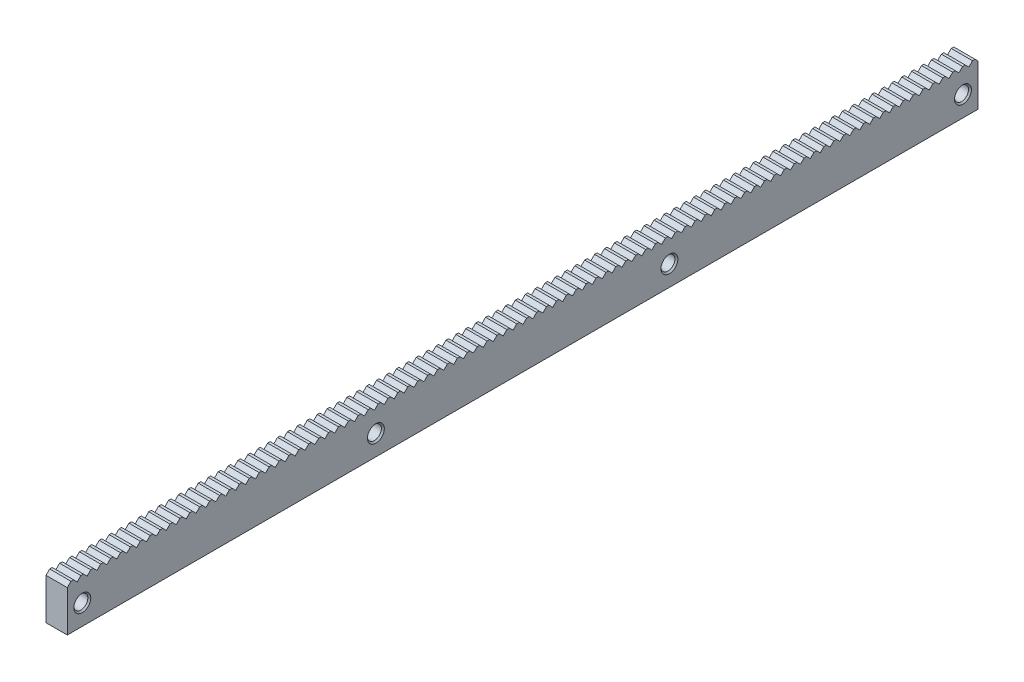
SolidWorks part; units mm, degrees
ref_plane "Front Plane" through (0, 0, 0) normal (0, 0, 1) x (1, 0, 0)
ref_plane "Top Plane" through (0, 0, 0) normal (0, 1, 0) x (1, 0, 0)
ref_plane "Right Plane" through (0, 0, 0) normal (1, 0, 0) x (0, 0, -1)
sketch "Sketch1" plane through (0, 0, 0) normal (1, 0, 0) x (0, 0, -1)
  line L1 (124.1, -6.1) -> (-124.1, -6.1)
  line L2 (124.1, -6.1) -> (124.1, 6.1)
  line L3 (124.1, 6.1) -> (-124.1, 6.1)
  line L4 (-124.1, -6.1) -> (-124.1, 6.1)
  line L5 (124.1, -6.1) -> (-124.1, 6.1) construction
  line L6 (124.1, 6.1) -> (-124.1, -6.1) construction
  point P0 (0, 0)
  dimension "D1" = 248.2
  dimension "D2" = 12.2
extrude "Boss-Extrude1" add sketch "Sketch1" along normal mid plane 5.8
sketch "Sketch2" plane through (0, 0, 0) normal (1, 0, 0) x (0, 0, -1)
  line L0 (-124.1, 5.1) -> (-125.1, 6.1)
  line L1 (-124.1, 6.1) -> (-124.1, -6.1) construction
  line L2 (-125.1, 6.1) -> (-123.1, 6.1)
  line L3 (124.1, 6.1) -> (-124.1, 6.1) construction
  line L4 (-123.1, 6.1) -> (-124.1, 5.1)
  line L5 (-124.1, -6.1) -> (124.1, -6.1) construction
  point P8 (-124.1, 5.1)
  dimension "D1" = 11.2
extrude "Cut-Extrude1" cut sketch "Sketch2" against normal mid plane 5.8
pattern_linear "LPattern1" count 93 spacing 2.7 along (0, -0.7071, -0.7071) of "Cut-Extrude1"
sketch "Sketch3" plane through (0, 0, 0) normal (1, 0, 0) x (0, 0, -1)
  line L0 (-124.1, -6.1) -> (124.1, -6.1) construction
  line L1 (-124.1, 5.1) -> (-124.1, -6.1) construction
  circle A0 centre (-120, -0.56) radius 1.9
  dimension "D3" = 3.8
  dimension "D1" = 5.54
  dimension "D2" = 4.1
extrude "Cut-Extrude2" cut sketch "Sketch3" against normal mid plane 5.8
chamfer "Chamfer1" distance 0.4 angle 45 2 edges at (-2.9, -0.56, 118.1) (2.9, -0.56, 118.1)
pattern_linear "LPattern2" count 4 spacing 80 along (0, 0, -1) of "Cut-Extrude2", "Chamfer1"
